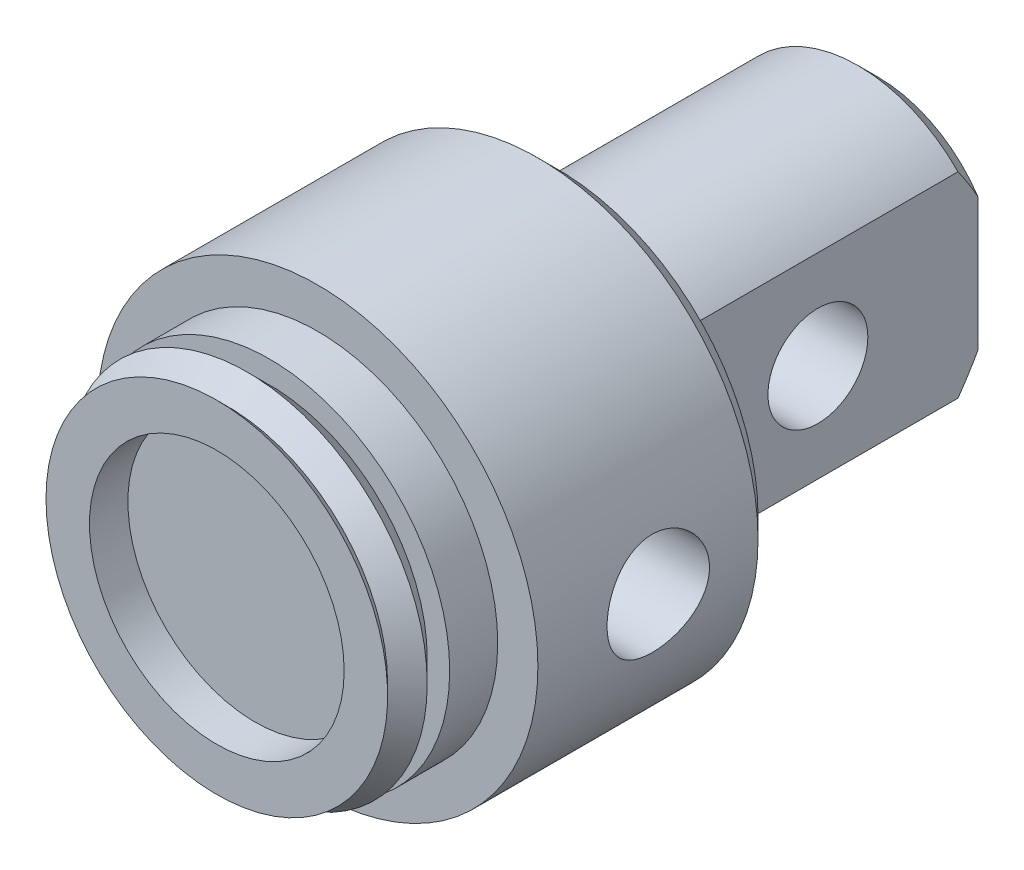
SolidWorks part; units mm, degrees
ref_plane "Front" through (0, 0, 0) normal (0, 0, 1) x (1, 0, 0)
ref_plane "Top" through (0, 0, 0) normal (0, 1, 0) x (1, 0, 0)
ref_plane "Right" through (0, 0, 0) normal (1, 0, 0) x (0, 0, -1)
sketch "Sketch1" plane through (0, 0, 0) normal (1, 0, 0) x (0, 0, -1)
  line L0 (71.2941, 0) -> (-67.6458, 0) construction
  line L1 (0, 0) -> (0, 6.7754)
  line L2 (0, 6.7754) -> (0.4166, 6.3589)
  line L3 (0.4166, 6.3589) -> (1.2014, 7.1437)
  line L4 (1.2014, 7.1437) -> (2.0932, 6.252)
  line L5 (2.0932, 6.252) -> (2.0932, 7.1437)
  line L6 (2.0932, 7.1437) -> (3.9982, 7.1437)
  line L7 (3.9982, 7.1437) -> (3.9982, 0)
  line L8 (3.9982, 0) -> (0, 0)
  dimension "D1" = 45
  dimension "D2" = 7.1437
  dimension "D3" = 7.1437
  dimension "D4" = 0.8918
  dimension "D5" = 1.2014
  dimension "D6" = 6.7754
  dimension "Back Length" = 1.905
revolve "Base" add sketch "Sketch1" angle 360 about L0
chamfer "Back Chamfer" [suppressed] distance 0.7937 angle 45
sketch "Sketch2" plane through (0, 0, -3.9982) normal (0, 0, -1) x (-1, 0, 0)
  line L0 (6.6282, 0) -> (-6.4494, 0) construction
  line L1 (7.62, 4.7625) -> (-7.62, 4.7625)
  line L2 (7.62, -4.7625) -> (-7.62, -4.7625)
  line L3 (-7.62, 4.7625) -> (-7.62, 17.4625)
  line L4 (-7.62, -4.7625) -> (-7.62, -17.4625)
  line L5 (-7.62, 17.4625) -> (7.62, 17.4625)
  line L6 (-7.62, -17.4625) -> (7.62, -17.4625)
  line L7 (7.62, 17.4625) -> (7.62, 4.7625)
  line L8 (7.62, -17.4625) -> (7.62, -4.7625)
  point P5 (0, 4.7625)
  dimension "D1" = 9.525
  dimension "D2" = 12.7
  dimension "D3" = 15.24
extrude "Flats Cut" [suppressed] cut sketch "Sketch2" against normal blind 3.9688
sketch "Sketch4" plane through (0, 0, -3.9982) normal (0, 0, -1) x (-1, 0, 0)
  circle A0 centre (0, 0) radius 8.7376
  dimension "D1" = 17.4752
extrude "Body" add sketch "Sketch4" along normal blind 9.525
sketch "Sketch5" plane through (0, 0, -13.5232) normal (0, 0, -1) x (-1, 0, 0)
  circle A0 centre (0, 0) radius 5.5562
  dimension "D1" = 11.1125
extrude "Body 2" add sketch "Sketch5" along normal blind 12.7
chamfer "Body Chamfer" distance 0.7937 angle 45 2 edges at (-8.7376, 0, -13.5232) (-5.5562, 0, -26.2232)
sketch "Sketch6" plane through (0, 0, -26.2232) normal (0, 0, -1) x (-1, 0, 0)
  line L0 (0, 6.5811) -> (0, -6.7371) construction
  line L1 (-3.9687, 6.35) -> (-3.9687, -6.35)
  line L2 (3.9688, 6.35) -> (6.5088, 6.35)
  line L3 (3.9688, 6.35) -> (3.9688, -6.35)
  line L4 (3.9688, -6.35) -> (6.5088, -6.35)
  line L5 (6.5088, 6.35) -> (6.5088, -6.35)
  line L6 (-3.9687, 6.35) -> (-6.5087, 6.35)
  line L7 (-6.5087, 6.35) -> (-6.5087, -6.35)
  line L8 (-3.9687, -6.35) -> (-6.5087, -6.35)
  point P11 (3.9688, 0)
  dimension "D1" = 7.9375
  dimension "D2" = 2.54
  dimension "D3" = 12.7
extrude "Body 2 Flats Cut" cut sketch "Sketch6" against normal blind 11.8872
sketch "Sketch7" plane through (3.9687, 0, 0) normal (1, 0, 0) x (0, 0, -1)
  line L0 (12.7295, 0) -> (3.9982, 0) construction
  line L1 (26.2232, -2.6326) -> (26.2232, 2.6326) construction
  circle A0 centre (19.8732, 0) radius 1.9812
  dimension "D2" = 3.9624
  dimension "D1" = 6.35
extrude "Body 2 Hole Cut" cut sketch "Sketch7" against normal through all
sketch "Sketch8" plane through (0, 0, 0) normal (1, 0, 0) x (0, 0, -1)
  line L0 (12.7295, 0) -> (3.9982, 0) construction
  line L1 (3.9982, 8.7376) -> (3.9982, -8.7376) construction
  circle A0 centre (8.7734, 0) radius 2.032
  dimension "D1" = 4.064
  dimension "B4 Body Hole Distance" = 4.7752
extrude "B1" cut sketch "Sketch8" along normal through all
sketch "Sketch12" [suppressed] plane through (0, 0, 0) normal (0, 1, 0) x (1, 0, 0)
  line L0 (-8.7376, 3.9982) -> (8.7376, 3.9982) construction
  circle A0 centre (0, 8.7734) radius 2.032
  dimension "D1" = 4.064
  dimension "B1 Body Hole Distance" = 4.7752
extrude "B2" [suppressed] cut sketch "Sketch12" along normal through all
sketch "Sketch9" [suppressed] plane through (0, 0, 0) normal (1, 0, 0) x (0, 0, -1)
  line L2 (3.9982, 8.7376) -> (3.9982, -8.7376) construction
  circle A0 centre (8.7734, 0) radius 2.032
  dimension "D1" = 4.064
  dimension "B2 Body Hole Distance" = 4.7752
extrude "B3" [suppressed] cut sketch "Sketch9" against normal through all
sketch "Sketch13" [suppressed] plane through (0, 0, 0) normal (0, 1, 0) x (1, 0, 0)
  line L1 (-8.7376, 3.9982) -> (8.7376, 3.9982) construction
  circle A0 centre (0, 8.7734) radius 2.032
  dimension "D1" = 4.064
  dimension "B3 Body Hole Distance" = 4.7752
extrude "B4" [suppressed] cut sketch "Sketch13" against normal through all
sketch "Sketch3" plane through (0, 0, 0) normal (0, 0, -1) x (-1, 0, 0)
  circle A0 centre (0, 0) radius 2.0447
  dimension "D1" = 4.0894
extrude "Hole Cut" [suppressed] cut sketch "Sketch3" along normal through all
sketch "Sketch14" plane through (0, 0, 0) normal (0, 0, 1) x (1, 0, 0)
  circle A0 centre (0, 0) radius 5.0509
extrude "Cut-Extrude1" cut sketch "Sketch14" against normal blind 1.524
